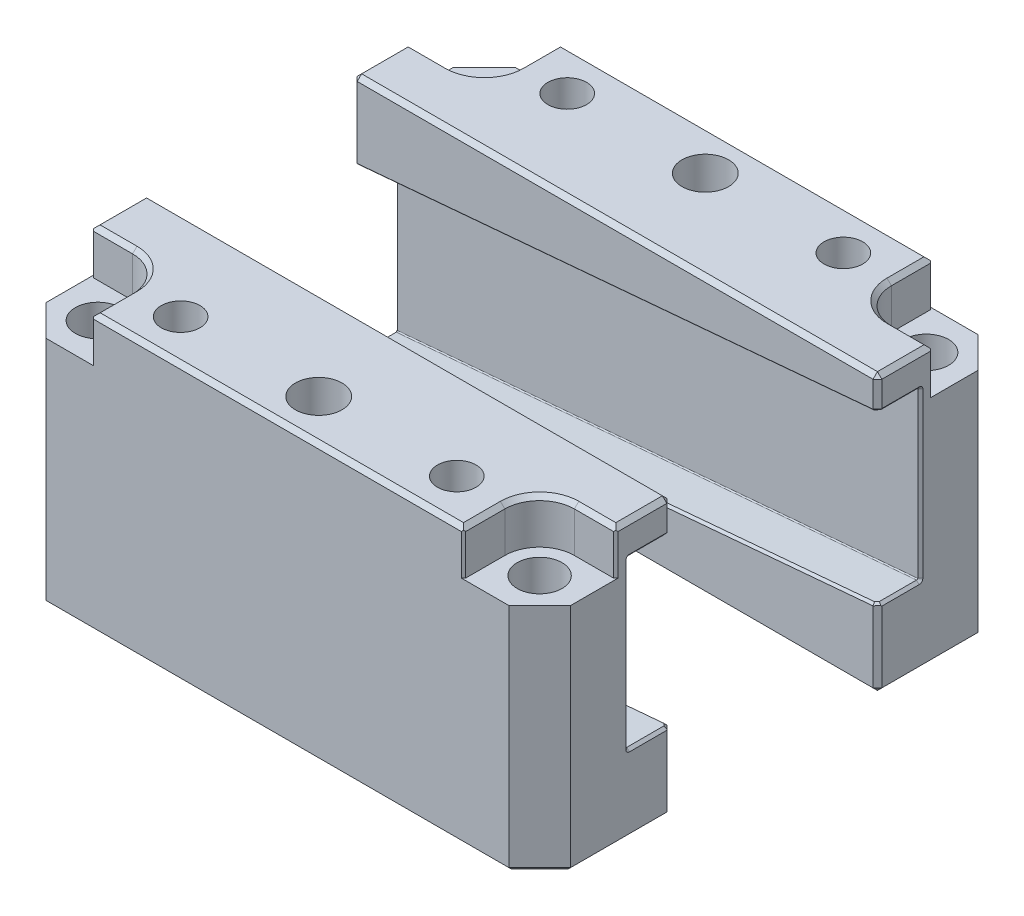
SolidWorks part; units mm, degrees
ref_plane "Front Plane" through (0, 0, 0) normal (0, 0, 1) x (1, 0, 0)
ref_plane "Top Plane" through (0, 0, 0) normal (0, 1, 0) x (1, 0, 0)
ref_plane "Right Plane" through (0, 0, 0) normal (1, 0, 0) x (0, 0, -1)
sketch "Sketch1" plane through (0, 0, 0) normal (1, 0, 0) x (0, 0, -1)
  line L0 (-23.7109, 0) -> (-23.7109, 63.5)
  line L1 (-23.7109, 63.5) -> (-53.9496, 63.5)
  line L2 (-53.9496, 63.5) -> (-53.9496, 0)
  line L3 (-53.9496, 0) -> (-23.7109, 0)
  line L4 (0, 48.255) -> (0, -16.2311) construction
  dimension "D1" = 47.4218
  dimension "D2" = 63.5
  dimension "D3" = 107.8992
  dimension "D4" = 30.2387
extrude "Boss-Extrude1" add sketch "Sketch1" along normal mid plane 120.65
hole_wizard "CBORE for 3/8 Socket Head Cap Screw3" positions "Sketch4" profile "Sketch3" counterbore size "3/8" standard "ANSI Inch"
sketch "Sketch4" plane through (0, 63.5, 0) normal (0, 1, 0) x (1, 0, 0)
  line L0 (0, 7.4267) -> (0, -36.2312) construction
  line L2 (-19.6518, 0) -> (14.0148, 0) construction
  point P0 (-50.8, -44.45)
  point P11 (50.8, -44.45)
  dimension "D1" = 101.6
  dimension "D2" = 88.9
sketch "Sketch3" plane through (-50.8, 63.5, 44.45) normal (1, 0, 0) x (0, 0, 1)
  line L0 (0, 0) -> (0, 63.5)
  line L1 (0, 63.5) -> (5.1587, 63.5)
  line L3 (5.1587, 63.5) -> (5.1587, 10.287)
  line L4 (5.1587, 10.287) -> (8.001, 10.287)
  line L5 (8.001, 10.287) -> (8.001, 0)
  line L7 (8.001, 0) -> (0, 0)
  line L11 (0, -6.35) -> (0, 107.95) construction
  dimension "Thru Hole Dia." = 10.3175
  dimension "Thru Hole Depth" = 63.5
  dimension "C'Bore Dia." = 16.002
  dimension "C'Bore Depth" = 10.287
hole_wizard "1/2-13 Tapped Hole1" positions "Sketch6" profile "Sketch5" tap size "1/2-13" standard "ANSI Inch"
sketch "Sketch6" plane through (0, 63.5, 0) normal (0, 1, 0) x (1, 0, 0)
  line L0 (0, 2.7703) -> (0, -32.9614) construction
  line L2 (-8.3627, 0) -> (4.6629, 0) construction
  line L4 (50.8, -44.45) -> (-50.8, -44.45) construction
  point P2 (0, -44.45)
sketch "Sketch5" plane through (0, 63.5, 44.45) normal (1, 0, 0) x (0, 0, 1)
  line L0 (0, 0) -> (0, 38.3985)
  line L1 (0, 38.3985) -> (5.3581, 35.179)
  line L2 (5.3581, 35.179) -> (5.3581, 0)
  line L5 (5.3581, 0) -> (0, 0)
  line L10 (0, 38.3985) -> (-5.3581, 35.179) construction
  line L11 (0, -6.35) -> (0, 107.95) construction
  dimension "Tap Drill Dia." = 10.7163
  dimension "Tap Drill Depth" = 35.179
  dimension "Drill Angle" = 118
chamfer "Chamfer1" distance 7.112 angle 45 2 edges at (60.325, 31.75, 53.9496) (-60.325, 31.75, 53.9496)
ref_plane "Plane3" through (0, 0, 44.45) normal (0, 0, 1) x (1, 0, 0)
sketch "Sketch17" plane through (0, 0, 44.45) normal (0, 0, 1) x (1, 0, 0)
  line L0 (-36.195, 63.5) -> (-36.195, 22.7968)
  line L1 (-36.195, 22.7968) -> (-36.5125, 22.606)
  line L2 (-36.5125, 22.606) -> (-36.5125, 0)
  line L3 (-36.5125, 0) -> (-31.75, 0)
  line L4 (-31.75, 0) -> (-31.75, 63.5)
  line L5 (-31.75, 63.5) -> (-36.195, 63.5)
  line L6 (-31.75, 80.1523) -> (-31.75, -4.206) construction
  line L7 (53.213, 0) -> (-53.213, 0) construction
  line L8 (53.213, 63.5) -> (-53.213, 63.5) construction
  line L9 (0, 0) -> (0, 80.1523) construction
  dimension "D1" = 22.606
  dimension "D2" = 59
  dimension "D3" = 8.89
  dimension "D4" = 9.525
  dimension "D5" = 63.5
revolve "Cut-Revolve2" cut sketch "Sketch17" angle 360 about L6
mirror "Mirror1" about plane through (0, 0, 0) normal (1, 0, 0) of "Cut-Revolve2"
sketch "Sketch8" plane through (0, 63.5, 0) normal (0, 1, 0) x (1, 0, 0)
  line L0 (-50.8, -36.449) -> (-60.325, -36.449)
  line L2 (-60.325, -23.7109) -> (-60.325, -46.8376) construction
  line L3 (-60.325, -36.449) -> (-60.325, -53.9496)
  line L4 (-60.325, -53.9496) -> (-42.799, -53.9496)
  line L5 (53.213, -53.9496) -> (-53.213, -53.9496) construction
  line L6 (-42.799, -53.9496) -> (-42.799, -44.45)
  line L7 (0, -15.8994) -> (0, -62.4302) construction
  line L8 (42.799, -53.9496) -> (42.799, -44.45)
  line L9 (60.325, -53.9496) -> (42.799, -53.9496)
  line L10 (60.325, -36.449) -> (60.325, -53.9496)
  line L11 (50.8, -36.449) -> (60.325, -36.449)
  circle A0 centre (-50.8, -44.45) radius 8.001 construction
  circle A1 centre (-50.8, -44.45) radius 8.001 construction
  arc A2 (-42.799, -44.45) -> (-50.8, -36.449) centre (-50.8, -44.45) ccw
  arc A3 (42.799, -44.45) -> (50.8, -36.449) centre (50.8, -44.45) cw
extrude "Cut-Extrude3" cut sketch "Sketch8" against normal up to surface (10.287 mm away)
sketch "Sketch9" plane through (0, 0, 23.7109) normal (0, 0, -1) x (-1, 0, 0)
  line L0 (0, 63.5) -> (0, 0) construction
  line L1 (-60.325, 63.5) -> (60.325, 63.5) construction
  line L2 (60.325, 0) -> (60.325, 63.5) construction
  line L3 (-60.325, 56.0995) -> (60.325, 45.544)
  line L4 (-60.325, 56.0995) -> (-60.325, 17.956)
  line L5 (-60.325, 17.956) -> (60.325, 7.4005)
  line L6 (60.325, 45.544) -> (60.325, 7.4005)
  line L7 (-60.325, 56.0995) -> (60.325, 7.4005) construction
  line L8 (-60.325, 17.956) -> (60.325, 45.544) construction
  line L9 (12.9005, 31.75) -> (-13.5117, 31.75) construction
  point P5 (0, 31.75)
  dimension "D1" = 37.9984
  dimension "D2" = 5
extrude "Cut-Extrude4" cut sketch "Sketch9" against normal offset from surface (9.8425 mm away) 33.5534
hole_wizard "1/2-13 Tapped Hole2" positions "Sketch11" profile "Sketch10" tap size "1/2-13" standard "ANSI Inch"
sketch "Sketch11" plane through (0, 0, 0) normal (0, -1, 0) x (-1, 0, 0)
  point P0 (50.8, -44.45)
  point P3 (-50.8, -44.45)
sketch "Sketch10" plane through (-50.8, 0, 44.45) normal (1, 0, 0) x (0, 0, -1)
  line L0 (0, 0) -> (0, 38.3985)
  line L1 (0, 38.3985) -> (5.3581, 35.179)
  line L2 (5.3581, 35.179) -> (5.3581, 0)
  line L5 (5.3581, 0) -> (0, 0)
  line L10 (0, 38.3985) -> (-5.3581, 35.179) construction
  line L11 (0, -6.35) -> (0, 107.95) construction
  dimension "Tap Drill Dia." = 10.7163
  dimension "Tap Drill Depth" = 35.179
  dimension "Drill Angle" = 118
ref_plane "Plane1" through (-2.7567, 31.5088, 0) normal (-0.0872, 0.9962, 0) x (0.9962, 0.0872, 0)
fillet "Fillet1" radius 0.254 2 edges at (0, 12.6782, 33.5534) (0, 50.8218, 33.5534)
chamfer "Chamfer2" distance 1.016 angle 45 20 edges at (0, 0, 23.7109) (60.325, 8.978, 23.7109) (60.325, 0, 35.2742) (56.769, 0, 50.3936) (0, 0, 53.9496) (-56.769, 0, 50.3936) (-60.325, 0, 35.2742) (-60.325, 3.7002, 23.7109) (-45.1424, 63.5, 38.7924) (-60.325, 63.5, 30.08) (-60.325, 54.522, 23.7109) (0, 63.5, 23.7109) (0, 63.5, 53.9496) (45.1424, 63.5, 38.7924) (60.325, 63.5, 30.0799) (60.325, 59.7998, 23.7109) (-42.799, 63.5, 49.1998) (-55.5625, 63.5, 36.449) (42.799, 63.5, 49.1998) (55.5625, 63.5, 36.449)
chamfer "Chamfer3" distance 0.508 angle 45 20 edges at (-59.817, 7.4449, 24.2189) (0, 12.6782, 23.7109) (59.817, 17.9115, 24.2189) (-60.325, 7.4005, 29.0132) (60.325, 17.956, 29.0132) (-60.325, 7.4752, 33.479) (60.325, 18.0307, 33.479) (-60.325, 26.4722, 33.5534) (60.325, 37.0278, 33.5534) (-60.325, 45.4693, 33.479) (60.325, 56.0248, 33.479) (-60.325, 45.544, 29.0132) (-59.817, 45.5885, 24.2189) (0, 50.8218, 23.7109) (59.817, 56.0551, 24.2189) (60.325, 56.0995, 29.0131) (60.325, 57.8485, 36.449) (42.799, 57.8485, 53.9496) (-42.799, 57.8485, 53.9496) (-60.325, 57.8485, 36.449)
ref_plane "Plane2" through (38.1, 0, 0) normal (1, 0, 0) x (0, 0, -1)
sketch "Sketch18" plane through (38.1, 0, 0) normal (1, 0, 0) x (0, 0, -1)
  line L0 (-31.75, 0) -> (-31.75, 10.7402) construction
  line L1 (-24.7269, 0) -> (-46.4168, 0) construction
  line L2 (-44.45, 38.1529) -> (-44.45, -38.1529) construction
  line L3 (-29.75, 0) -> (-29.75, 6.096)
  line L4 (-29.75, 6.096) -> (-31.75, 7.2507)
  line L5 (-31.75, 7.2507) -> (-31.75, 0)
  line L6 (-31.75, 0) -> (-29.75, 0)
  dimension "D1" = 12.7
  dimension "D2" = 4
  dimension "D3" = 6.096
  dimension "D4" = 60
revolve "Cut-Revolve3" cut sketch "Sketch18" angle 360 about L0
chamfer "Chamfer4" distance 0.508 angle 45 2 edges at (36.5125, 0, 44.45) (-36.5125, 0, 44.45)
mirror "Mirror2" about plane through (0, 0, 0) normal (0, 0, 1)
